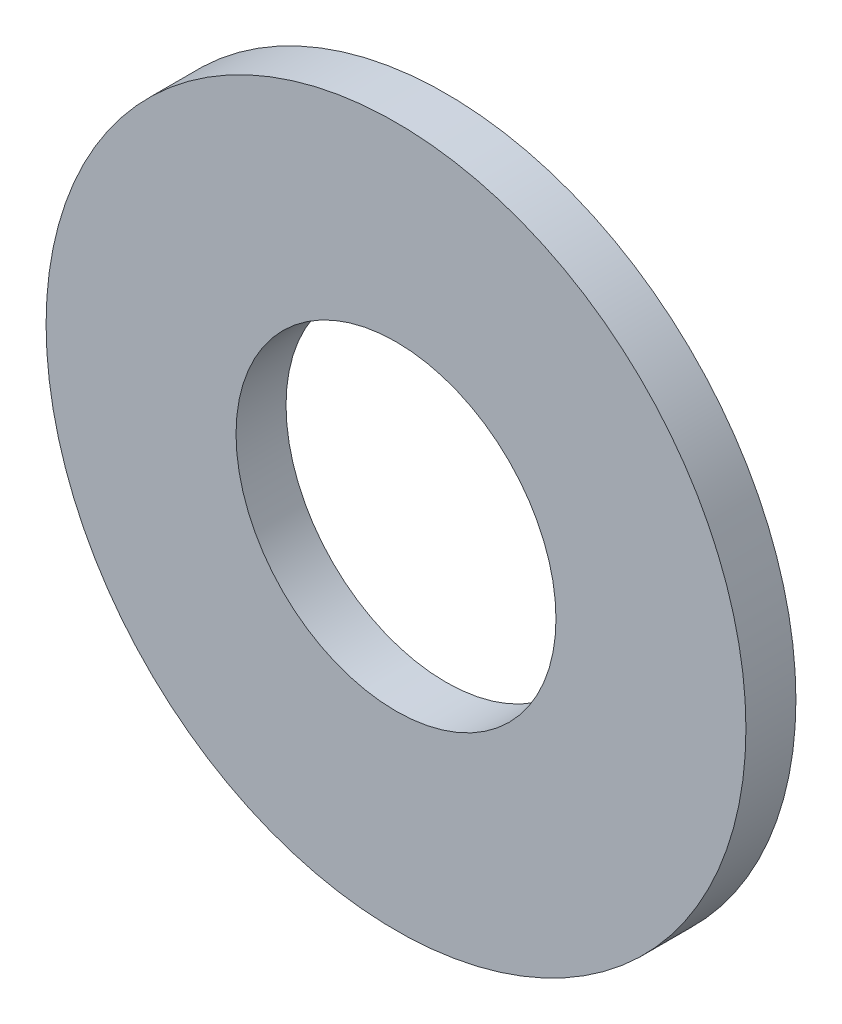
SolidWorks part; units mm, degrees
ref_plane "Front Plane" through (0, 0, 0) normal (0, 0, 1) x (1, 0, 0)
ref_plane "Top Plane" through (0, 0, 0) normal (0, 1, 0) x (1, 0, 0)
ref_plane "Right Plane" through (0, 0, 0) normal (1, 0, 0) x (0, 0, -1)
sketch "Sketch1" plane through (0, 0, 0) normal (0, 0, 1) x (1, 0, 0)
  circle A0 centre (0, 0) radius 3.5
  dimension "D1" = 7
extrude "Boss-Extrude1" add sketch "Sketch1" against normal blind 0.5
sketch "Sketch2" plane through (0, 0, 0) normal (0, 0, 1) x (1, 0, 0)
  circle A0 centre (0, 0) radius 1.6
  dimension "D1" = 3.2
extrude "Cut-Extrude1" cut sketch "Sketch2" along normal through all and the other way through all
